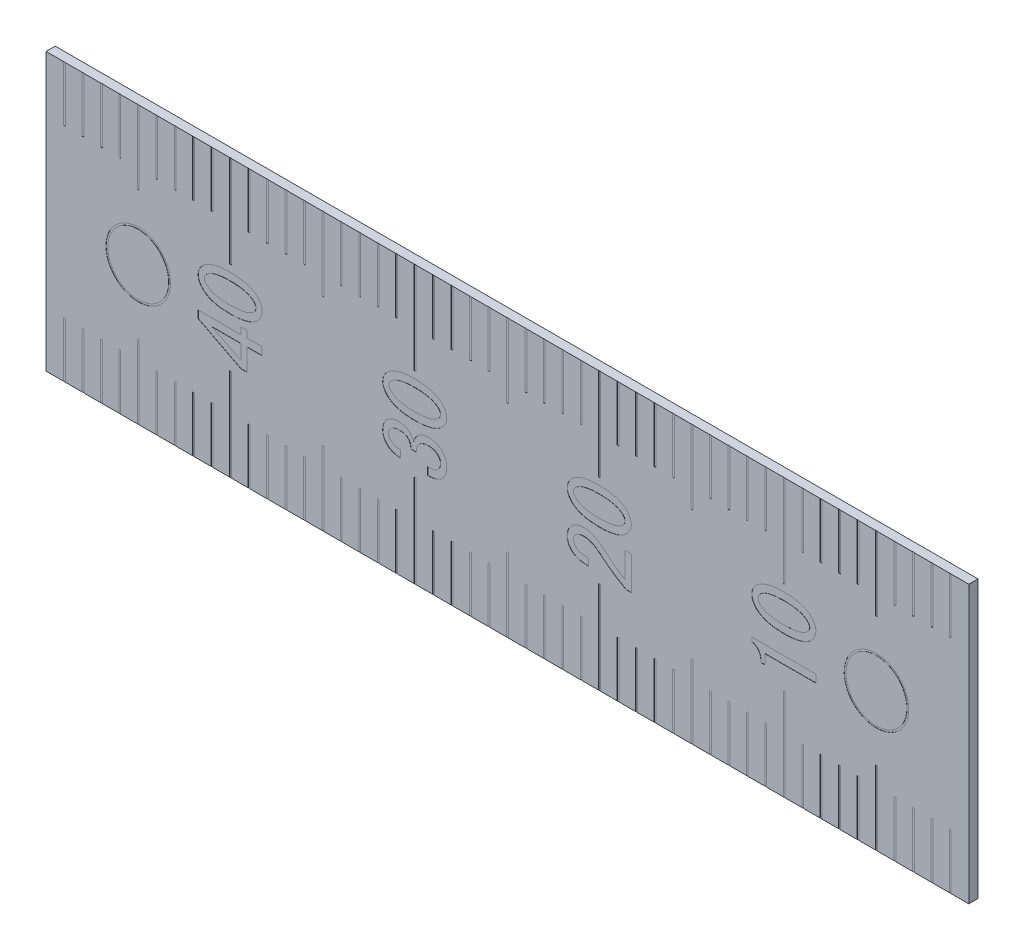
SolidWorks part; units mm, degrees
ref_plane "Front" through (0, 0, 0) normal (0, 0, 1) x (1, 0, 0)
ref_plane "Top" through (0, 0, 0) normal (0, 1, 0) x (1, 0, 0)
ref_plane "Right" through (0, 0, 0) normal (1, 0, 0) x (0, 0, -1)
sketch "Sketch1" plane through (0, 0, 0) normal (0, 0, 1) x (1, 0, 0)
  line L1 (0, 0) -> (0, 50)
  line L2 (0, 0) -> (15, 0)
  line L3 (15, 0) -> (15, 50)
  line L4 (0, 50) -> (15, 50)
  dimension "D1" = 50
  dimension "D2" = 15
extrude "Extrude1" add sketch "Sketch1" along normal blind 0.5
sketch "Sketch2" plane through (0, 0, 0.5) normal (0, 0, 1) x (1, 0, 0)
  line L0 (0, 50) -> (0, 0) construction
  line L1 (0, 0) -> (15, 0) construction
  line L2 (15, 50) -> (0, 50) construction
  circle A0 centre (7.5, 5) radius 1.75
  circle A1 centre (7.5, 45) radius 1.75
  circle A2 centre (7.5, 5) radius 1.65
  circle A3 centre (7.5, 45) radius 1.65
  dimension "D1" = 7.5
  dimension "D2" = 7.5
  dimension "D3" = 5
  dimension "D4" = 5
  dimension "D5" = 3.5
  dimension "D6" = 3.5
  dimension "D7" = 0.1
extrude "Extrude2" cut sketch "Sketch2" against normal blind 0.01
sketch "Sketch3" plane through (0, 0, 0.5) normal (0, 0, 1) x (1, 0, 0)
  line L0 (15, 50) -> (0, 50) construction
  line L1 (5.25, 28.25) -> (9.75, 28.25) construction
  line L2 (5.25, 18.25) -> (9.75, 18.25) construction
  line L3 (5.25, 8.25) -> (9.75, 8.25) construction
  line L5 (0, 50) -> (0, 0) construction
  line L7 (5.25, 38.25) -> (9.75, 38.25) construction
  line L8 (5.25, 38.25) -> (5.25, 41.75) construction
  line L9 (7.5, 0) -> (7.5, 50) construction
  line L10 (0, 0) -> (15, 0) construction
  line L11 (0, 40) -> (15, 40) construction
  line L12 (15, 0) -> (15, 50) construction
  line L13 (5.25, 41.75) -> (9.75, 41.75) construction
  line L14 (9.75, 38.25) -> (9.75, 41.75) construction
  line L15 (5.25, 38.25) -> (9.75, 41.75) construction
  line L16 (5.25, 41.75) -> (9.75, 38.25) construction
  circle A0 centre (7.5, 45) radius 1.75 construction
  text T0 "40" font "ＭＳ ゴシック" height 3.5
  text T1 "30" font "ＭＳ ゴシック" height 3.5
  text T2 "20" font "ＭＳ ゴシック" height 3.5
  text T3 "10" font "ＭＳ ゴシック" height 3.5
  point P7 (7.5, 40)
  dimension "D2" = 7.5
  dimension "D1" = 4
  dimension "D6" = 10
  dimension "D5" = 4.5
  dimension "D7" = 3.5
extrude "Extrude3" cut sketch "Sketch3" against normal blind 0.01
sketch "Sketch4" plane through (0, 0, 0.5) normal (0, 0, 1) x (1, 0, 0)
  line L0 (15, 40.05) -> (10, 40.05)
  line L1 (15, 0) -> (15, 50) construction
  line L2 (10, 40.05) -> (10, 39.95)
  line L3 (10, 39.95) -> (15, 39.95)
  line L4 (15, 39.95) -> (15, 40.05)
  line L5 (15, 50) -> (0, 50) construction
  line L6 (15, 48.05) -> (15, 47.95)
  line L7 (15, 44.95) -> (11, 44.95)
  line L8 (15, 44.95) -> (15, 45.05)
  line L9 (15, 45.05) -> (11, 45.05)
  line L10 (11, 44.95) -> (11, 45.05)
  line L11 (15, 49.05) -> (12, 49.05)
  line L12 (15, 49.05) -> (15, 48.95)
  line L13 (15, 48.95) -> (12, 48.95)
  line L14 (12, 49.05) -> (12, 48.95)
  line L15 (15, 48.05) -> (12, 48.05)
  line L16 (15, 47.95) -> (12, 47.95)
  line L17 (12, 48.05) -> (12, 47.95)
  line L18 (15, 47.05) -> (15, 46.95)
  line L19 (15, 47.05) -> (12, 47.05)
  line L20 (15, 46.95) -> (12, 46.95)
  line L21 (12, 47.05) -> (12, 46.95)
  line L22 (15, 46.05) -> (15, 45.95)
  line L23 (15, 46.05) -> (12, 46.05)
  line L24 (15, 45.95) -> (12, 45.95)
  line L25 (12, 46.05) -> (12, 45.95)
  line L26 (15, 30.05) -> (10, 30.05)
  line L27 (10, 30.05) -> (10, 29.95)
  line L28 (10, 29.95) -> (15, 29.95)
  line L29 (15, 29.95) -> (15, 30.05)
  line L30 (15, 44.05) -> (15, 43.95)
  line L31 (15, 44.05) -> (12, 44.05)
  line L32 (15, 43.95) -> (12, 43.95)
  line L33 (12, 44.05) -> (12, 43.95)
  line L34 (15, 43.05) -> (15, 42.95)
  line L35 (15, 43.05) -> (12, 43.05)
  line L36 (15, 42.95) -> (12, 42.95)
  line L37 (12, 43.05) -> (12, 42.95)
  line L38 (15, 42.05) -> (15, 41.95)
  line L39 (15, 42.05) -> (12, 42.05)
  line L40 (15, 41.95) -> (12, 41.95)
  line L41 (12, 42.05) -> (12, 41.95)
  line L42 (15, 41.05) -> (15, 40.95)
  line L43 (15, 41.05) -> (12, 41.05)
  line L44 (15, 40.95) -> (12, 40.95)
  line L45 (12, 41.05) -> (12, 40.95)
  line L46 (12, 45.05) -> (12, 44.95)
  line L47 (15, 45.05) -> (12, 45.05)
  line L48 (15, 44.95) -> (12, 44.95)
  line L49 (15, 45.05) -> (15, 44.95)
  line L50 (15, 38.05) -> (15, 37.95)
  line L51 (15, 34.95) -> (11, 34.95)
  line L52 (15, 34.95) -> (15, 35.05)
  line L53 (15, 35.05) -> (11, 35.05)
  line L54 (11, 34.95) -> (11, 35.05)
  line L55 (15, 39.05) -> (12, 39.05)
  line L56 (15, 39.05) -> (15, 38.95)
  line L57 (15, 38.95) -> (12, 38.95)
  line L58 (12, 39.05) -> (12, 38.95)
  line L59 (15, 38.05) -> (12, 38.05)
  line L60 (15, 37.95) -> (12, 37.95)
  line L61 (12, 38.05) -> (12, 37.95)
  line L62 (15, 37.05) -> (15, 36.95)
  line L63 (15, 37.05) -> (12, 37.05)
  line L64 (15, 36.95) -> (12, 36.95)
  line L65 (12, 37.05) -> (12, 36.95)
  line L66 (15, 36.05) -> (15, 35.95)
  line L67 (15, 36.05) -> (12, 36.05)
  line L68 (15, 35.95) -> (12, 35.95)
  line L69 (12, 36.05) -> (12, 35.95)
  line L70 (15, 34.05) -> (15, 33.95)
  line L71 (15, 34.05) -> (12, 34.05)
  line L72 (15, 33.95) -> (12, 33.95)
  line L73 (12, 34.05) -> (12, 33.95)
  line L74 (15, 33.05) -> (15, 32.95)
  line L75 (15, 33.05) -> (12, 33.05)
  line L76 (15, 32.95) -> (12, 32.95)
  line L77 (12, 33.05) -> (12, 32.95)
  line L78 (15, 32.05) -> (15, 31.95)
  line L79 (15, 32.05) -> (12, 32.05)
  line L80 (15, 31.95) -> (12, 31.95)
  line L81 (12, 32.05) -> (12, 31.95)
  line L82 (15, 31.05) -> (15, 30.95)
  line L83 (15, 31.05) -> (12, 31.05)
  line L84 (15, 30.95) -> (12, 30.95)
  line L85 (12, 31.05) -> (12, 30.95)
  line L86 (15, 20.05) -> (10, 20.05)
  line L87 (10, 20.05) -> (10, 19.95)
  line L88 (10, 19.95) -> (15, 19.95)
  line L89 (15, 19.95) -> (15, 20.05)
  line L90 (15, 28.05) -> (15, 27.95)
  line L91 (15, 24.95) -> (11, 24.95)
  line L92 (15, 24.95) -> (15, 25.05)
  line L93 (15, 25.05) -> (11, 25.05)
  line L94 (11, 24.95) -> (11, 25.05)
  line L95 (15, 29.05) -> (12, 29.05)
  line L96 (15, 29.05) -> (15, 28.95)
  line L97 (15, 28.95) -> (12, 28.95)
  line L98 (12, 29.05) -> (12, 28.95)
  line L99 (15, 28.05) -> (12, 28.05)
  line L100 (15, 27.95) -> (12, 27.95)
  line L101 (12, 28.05) -> (12, 27.95)
  line L102 (15, 27.05) -> (15, 26.95)
  line L103 (15, 27.05) -> (12, 27.05)
  line L104 (15, 26.95) -> (12, 26.95)
  line L105 (12, 27.05) -> (12, 26.95)
  line L106 (15, 26.05) -> (15, 25.95)
  line L107 (15, 26.05) -> (12, 26.05)
  line L108 (15, 25.95) -> (12, 25.95)
  line L109 (12, 26.05) -> (12, 25.95)
  line L110 (15, 24.05) -> (15, 23.95)
  line L111 (15, 24.05) -> (12, 24.05)
  line L112 (15, 23.95) -> (12, 23.95)
  line L113 (12, 24.05) -> (12, 23.95)
  line L114 (15, 23.05) -> (15, 22.95)
  line L115 (15, 23.05) -> (12, 23.05)
  line L116 (15, 22.95) -> (12, 22.95)
  line L117 (12, 23.05) -> (12, 22.95)
  line L118 (15, 22.05) -> (15, 21.95)
  line L119 (15, 22.05) -> (12, 22.05)
  line L120 (15, 21.95) -> (12, 21.95)
  line L121 (12, 22.05) -> (12, 21.95)
  line L122 (15, 21.05) -> (15, 20.95)
  line L123 (15, 21.05) -> (12, 21.05)
  line L124 (15, 20.95) -> (12, 20.95)
  line L125 (12, 21.05) -> (12, 20.95)
  line L126 (15, 10.05) -> (10, 10.05)
  line L127 (10, 10.05) -> (10, 9.95)
  line L128 (10, 9.95) -> (15, 9.95)
  line L129 (15, 9.95) -> (15, 10.05)
  line L130 (15, 18.05) -> (15, 17.95)
  line L131 (15, 14.95) -> (11, 14.95)
  line L132 (15, 14.95) -> (15, 15.05)
  line L133 (15, 15.05) -> (11, 15.05)
  line L134 (11, 14.95) -> (11, 15.05)
  line L135 (15, 19.05) -> (12, 19.05)
  line L136 (15, 19.05) -> (15, 18.95)
  line L137 (15, 18.95) -> (12, 18.95)
  line L138 (12, 19.05) -> (12, 18.95)
  line L139 (15, 18.05) -> (12, 18.05)
  line L140 (15, 17.95) -> (12, 17.95)
  line L141 (12, 18.05) -> (12, 17.95)
  line L142 (15, 17.05) -> (15, 16.95)
  line L143 (15, 17.05) -> (12, 17.05)
  line L144 (15, 16.95) -> (12, 16.95)
  line L145 (12, 17.05) -> (12, 16.95)
  line L146 (15, 16.05) -> (15, 15.95)
  line L147 (15, 16.05) -> (12, 16.05)
  line L148 (15, 15.95) -> (12, 15.95)
  line L149 (12, 16.05) -> (12, 15.95)
  line L150 (15, 14.05) -> (15, 13.95)
  line L151 (15, 14.05) -> (12, 14.05)
  line L152 (15, 13.95) -> (12, 13.95)
  line L153 (12, 14.05) -> (12, 13.95)
  line L154 (15, 13.05) -> (15, 12.95)
  line L155 (15, 13.05) -> (12, 13.05)
  line L156 (15, 12.95) -> (12, 12.95)
  line L157 (12, 13.05) -> (12, 12.95)
  line L158 (15, 12.05) -> (15, 11.95)
  line L159 (15, 12.05) -> (12, 12.05)
  line L160 (15, 11.95) -> (12, 11.95)
  line L161 (12, 12.05) -> (12, 11.95)
  line L162 (15, 11.05) -> (15, 10.95)
  line L163 (15, 11.05) -> (12, 11.05)
  line L164 (15, 10.95) -> (12, 10.95)
  line L165 (12, 11.05) -> (12, 10.95)
  line L166 (7.5, 50) -> (7.5, 36.693) construction
  line L167 (3, 1.05) -> (3, 0.95)
  line L168 (0, 0.95) -> (3, 0.95)
  line L169 (0, 1.05) -> (3, 1.05)
  line L170 (15, 8.05) -> (15, 7.95)
  line L171 (15, 4.95) -> (11, 4.95)
  line L172 (15, 4.95) -> (15, 5.05)
  line L173 (15, 5.05) -> (11, 5.05)
  line L174 (11, 4.95) -> (11, 5.05)
  line L175 (15, 9.05) -> (12, 9.05)
  line L176 (15, 9.05) -> (15, 8.95)
  line L177 (15, 8.95) -> (12, 8.95)
  line L178 (12, 9.05) -> (12, 8.95)
  line L179 (15, 8.05) -> (12, 8.05)
  line L180 (15, 7.95) -> (12, 7.95)
  line L181 (12, 8.05) -> (12, 7.95)
  line L182 (15, 7.05) -> (15, 6.95)
  line L183 (15, 7.05) -> (12, 7.05)
  line L184 (15, 6.95) -> (12, 6.95)
  line L185 (12, 7.05) -> (12, 6.95)
  line L186 (15, 6.05) -> (15, 5.95)
  line L187 (15, 6.05) -> (12, 6.05)
  line L188 (15, 5.95) -> (12, 5.95)
  line L189 (12, 6.05) -> (12, 5.95)
  line L190 (15, 4.05) -> (15, 3.95)
  line L191 (15, 4.05) -> (12, 4.05)
  line L192 (15, 3.95) -> (12, 3.95)
  line L193 (12, 4.05) -> (12, 3.95)
  line L194 (15, 3.05) -> (15, 2.95)
  line L195 (15, 3.05) -> (12, 3.05)
  line L196 (15, 2.95) -> (12, 2.95)
  line L197 (12, 3.05) -> (12, 2.95)
  line L198 (15, 2.05) -> (15, 1.95)
  line L199 (15, 2.05) -> (12, 2.05)
  line L200 (15, 1.95) -> (12, 1.95)
  line L201 (12, 2.05) -> (12, 1.95)
  line L202 (15, 1.05) -> (15, 0.95)
  line L203 (15, 1.05) -> (12, 1.05)
  line L204 (15, 0.95) -> (12, 0.95)
  line L205 (12, 1.05) -> (12, 0.95)
  line L206 (15, 0.05) -> (10, 0.05)
  line L207 (10, 0.05) -> (10, -0.05)
  line L208 (10, -0.05) -> (15, -0.05)
  line L209 (15, -0.05) -> (15, 0.05)
  line L210 (0, 1.05) -> (0, 0.95)
  line L211 (3, 2.05) -> (3, 1.95)
  line L212 (0, 1.95) -> (3, 1.95)
  line L213 (0, 2.05) -> (3, 2.05)
  line L214 (0, 2.05) -> (0, 1.95)
  line L215 (3, 3.05) -> (3, 2.95)
  line L216 (0, 2.95) -> (3, 2.95)
  line L217 (0, 3.05) -> (3, 3.05)
  line L218 (0, 3.05) -> (0, 2.95)
  line L219 (3, 4.05) -> (3, 3.95)
  line L220 (0, 3.95) -> (3, 3.95)
  line L221 (0, 4.05) -> (3, 4.05)
  line L222 (0, 4.05) -> (0, 3.95)
  line L223 (3, 6.05) -> (3, 5.95)
  line L224 (0, 5.95) -> (3, 5.95)
  line L225 (0, 6.05) -> (3, 6.05)
  line L226 (0, 6.05) -> (0, 5.95)
  line L227 (3, 7.05) -> (3, 6.95)
  line L228 (0, 6.95) -> (3, 6.95)
  line L229 (0, 7.05) -> (3, 7.05)
  line L230 (0, 7.05) -> (0, 6.95)
  line L231 (3, 8.05) -> (3, 7.95)
  line L232 (0, 7.95) -> (3, 7.95)
  line L233 (0, 8.05) -> (3, 8.05)
  line L234 (3, 9.05) -> (3, 8.95)
  line L235 (0, 8.95) -> (3, 8.95)
  line L236 (0, 9.05) -> (0, 8.95)
  line L237 (0, 9.05) -> (3, 9.05)
  line L238 (4, 4.95) -> (4, 5.05)
  line L239 (0, 5.05) -> (4, 5.05)
  line L240 (0, 4.95) -> (0, 5.05)
  line L241 (0, 4.95) -> (4, 4.95)
  line L242 (0, 8.05) -> (0, 7.95)
  line L243 (3, 11.05) -> (3, 10.95)
  line L244 (0, 10.95) -> (3, 10.95)
  line L245 (0, 11.05) -> (3, 11.05)
  line L246 (0, 11.05) -> (0, 10.95)
  line L247 (3, 12.05) -> (3, 11.95)
  line L248 (0, 11.95) -> (3, 11.95)
  line L249 (0, 12.05) -> (3, 12.05)
  line L250 (0, 12.05) -> (0, 11.95)
  line L251 (3, 13.05) -> (3, 12.95)
  line L252 (0, 12.95) -> (3, 12.95)
  line L253 (0, 13.05) -> (3, 13.05)
  line L254 (0, 13.05) -> (0, 12.95)
  line L255 (3, 14.05) -> (3, 13.95)
  line L256 (0, 13.95) -> (3, 13.95)
  line L257 (0, 14.05) -> (3, 14.05)
  line L258 (0, 14.05) -> (0, 13.95)
  line L259 (3, 16.05) -> (3, 15.95)
  line L260 (0, 15.95) -> (3, 15.95)
  line L261 (0, 16.05) -> (3, 16.05)
  line L262 (0, 16.05) -> (0, 15.95)
  line L263 (3, 17.05) -> (3, 16.95)
  line L264 (0, 16.95) -> (3, 16.95)
  line L265 (0, 17.05) -> (3, 17.05)
  line L266 (0, 17.05) -> (0, 16.95)
  line L267 (3, 18.05) -> (3, 17.95)
  line L268 (0, 17.95) -> (3, 17.95)
  line L269 (0, 18.05) -> (3, 18.05)
  line L270 (3, 19.05) -> (3, 18.95)
  line L271 (0, 18.95) -> (3, 18.95)
  line L272 (0, 19.05) -> (0, 18.95)
  line L273 (0, 19.05) -> (3, 19.05)
  line L274 (4, 14.95) -> (4, 15.05)
  line L275 (0, 15.05) -> (4, 15.05)
  line L276 (0, 14.95) -> (0, 15.05)
  line L277 (0, 14.95) -> (4, 14.95)
  line L278 (0, 18.05) -> (0, 17.95)
  line L279 (0, 9.95) -> (0, 10.05)
  line L280 (5, 9.95) -> (0, 9.95)
  line L281 (5, 10.05) -> (5, 9.95)
  line L282 (0, 10.05) -> (5, 10.05)
  line L283 (3, 21.05) -> (3, 20.95)
  line L284 (0, 20.95) -> (3, 20.95)
  line L285 (0, 21.05) -> (3, 21.05)
  line L286 (0, 21.05) -> (0, 20.95)
  line L287 (3, 22.05) -> (3, 21.95)
  line L288 (0, 21.95) -> (3, 21.95)
  line L289 (0, 22.05) -> (3, 22.05)
  line L290 (0, 22.05) -> (0, 21.95)
  line L291 (3, 23.05) -> (3, 22.95)
  line L292 (0, 22.95) -> (3, 22.95)
  line L293 (0, 23.05) -> (3, 23.05)
  line L294 (0, 23.05) -> (0, 22.95)
  line L295 (3, 24.05) -> (3, 23.95)
  line L296 (0, 23.95) -> (3, 23.95)
  line L297 (0, 24.05) -> (3, 24.05)
  line L298 (0, 24.05) -> (0, 23.95)
  line L299 (3, 26.05) -> (3, 25.95)
  line L300 (0, 25.95) -> (3, 25.95)
  line L301 (0, 26.05) -> (3, 26.05)
  line L302 (0, 26.05) -> (0, 25.95)
  line L303 (3, 27.05) -> (3, 26.95)
  line L304 (0, 26.95) -> (3, 26.95)
  line L305 (0, 27.05) -> (3, 27.05)
  line L306 (0, 27.05) -> (0, 26.95)
  line L307 (3, 28.05) -> (3, 27.95)
  line L308 (0, 27.95) -> (3, 27.95)
  line L309 (0, 28.05) -> (3, 28.05)
  line L310 (3, 29.05) -> (3, 28.95)
  line L311 (0, 28.95) -> (3, 28.95)
  line L312 (0, 29.05) -> (0, 28.95)
  line L313 (0, 29.05) -> (3, 29.05)
  line L314 (4, 24.95) -> (4, 25.05)
  line L315 (0, 25.05) -> (4, 25.05)
  line L316 (0, 24.95) -> (0, 25.05)
  line L317 (0, 24.95) -> (4, 24.95)
  line L318 (0, 28.05) -> (0, 27.95)
  line L319 (0, 19.95) -> (0, 20.05)
  line L320 (5, 19.95) -> (0, 19.95)
  line L321 (5, 20.05) -> (5, 19.95)
  line L322 (0, 20.05) -> (5, 20.05)
  line L323 (3, 31.05) -> (3, 30.95)
  line L324 (0, 30.95) -> (3, 30.95)
  line L325 (0, 31.05) -> (3, 31.05)
  line L326 (0, 31.05) -> (0, 30.95)
  line L327 (3, 32.05) -> (3, 31.95)
  line L328 (0, 31.95) -> (3, 31.95)
  line L329 (0, 32.05) -> (3, 32.05)
  line L330 (0, 32.05) -> (0, 31.95)
  line L331 (3, 33.05) -> (3, 32.95)
  line L332 (0, 32.95) -> (3, 32.95)
  line L333 (0, 33.05) -> (3, 33.05)
  line L334 (0, 33.05) -> (0, 32.95)
  line L335 (3, 34.05) -> (3, 33.95)
  line L336 (0, 33.95) -> (3, 33.95)
  line L337 (0, 34.05) -> (3, 34.05)
  line L338 (0, 34.05) -> (0, 33.95)
  line L339 (3, 36.05) -> (3, 35.95)
  line L340 (0, 35.95) -> (3, 35.95)
  line L341 (0, 36.05) -> (3, 36.05)
  line L342 (0, 36.05) -> (0, 35.95)
  line L343 (3, 37.05) -> (3, 36.95)
  line L344 (0, 36.95) -> (3, 36.95)
  line L345 (0, 37.05) -> (3, 37.05)
  line L346 (0, 37.05) -> (0, 36.95)
  line L347 (3, 38.05) -> (3, 37.95)
  line L348 (0, 37.95) -> (3, 37.95)
  line L349 (0, 38.05) -> (3, 38.05)
  line L350 (3, 39.05) -> (3, 38.95)
  line L351 (0, 38.95) -> (3, 38.95)
  line L352 (0, 39.05) -> (0, 38.95)
  line L353 (0, 39.05) -> (3, 39.05)
  line L354 (4, 34.95) -> (4, 35.05)
  line L355 (0, 35.05) -> (4, 35.05)
  line L356 (0, 34.95) -> (0, 35.05)
  line L357 (0, 34.95) -> (4, 34.95)
  line L358 (0, 38.05) -> (0, 37.95)
  line L359 (3, 41.05) -> (3, 40.95)
  line L360 (0, 40.95) -> (3, 40.95)
  line L361 (0, 41.05) -> (3, 41.05)
  line L362 (0, 41.05) -> (0, 40.95)
  line L363 (3, 42.05) -> (3, 41.95)
  line L364 (0, 41.95) -> (3, 41.95)
  line L365 (0, 42.05) -> (3, 42.05)
  line L366 (0, 42.05) -> (0, 41.95)
  line L367 (3, 43.05) -> (3, 42.95)
  line L368 (0, 42.95) -> (3, 42.95)
  line L369 (0, 43.05) -> (3, 43.05)
  line L370 (0, 43.05) -> (0, 42.95)
  line L371 (3, 44.05) -> (3, 43.95)
  line L372 (0, 43.95) -> (3, 43.95)
  line L373 (0, 44.05) -> (3, 44.05)
  line L374 (0, 44.05) -> (0, 43.95)
  line L375 (0, 29.95) -> (0, 30.05)
  line L376 (5, 29.95) -> (0, 29.95)
  line L377 (5, 30.05) -> (5, 29.95)
  line L378 (0, 30.05) -> (5, 30.05)
  line L379 (3, 46.05) -> (3, 45.95)
  line L380 (0, 45.95) -> (3, 45.95)
  line L381 (0, 46.05) -> (3, 46.05)
  line L382 (0, 46.05) -> (0, 45.95)
  line L383 (3, 47.05) -> (3, 46.95)
  line L384 (0, 46.95) -> (3, 46.95)
  line L385 (0, 47.05) -> (3, 47.05)
  line L386 (0, 47.05) -> (0, 46.95)
  line L387 (3, 48.05) -> (3, 47.95)
  line L388 (0, 47.95) -> (3, 47.95)
  line L389 (0, 48.05) -> (3, 48.05)
  line L390 (3, 49.05) -> (3, 48.95)
  line L391 (0, 48.95) -> (3, 48.95)
  line L392 (0, 49.05) -> (0, 48.95)
  line L393 (0, 49.05) -> (3, 49.05)
  line L394 (4, 44.95) -> (4, 45.05)
  line L395 (0, 45.05) -> (4, 45.05)
  line L396 (0, 44.95) -> (0, 45.05)
  line L397 (0, 44.95) -> (4, 44.95)
  line L398 (0, 48.05) -> (0, 47.95)
  line L399 (0, 39.95) -> (0, 40.05)
  line L400 (5, 39.95) -> (0, 39.95)
  line L401 (5, 40.05) -> (5, 39.95)
  line L402 (0, 40.05) -> (5, 40.05)
  point P4 (15, 40)
  point P13 (15, 45)
  point P18 (15, 49)
  dimension "D1" = 10
  dimension "D2" = 0.1
  dimension "D3" = 5
  dimension "D4" = 5
  dimension "D5" = 0.1
  dimension "D6" = 1
  dimension "D7" = 0.1
  dimension "D8" = 3
  dimension "D9" = 4
  dimension "D10" = 9
  dimension "D11" = 5
extrude "Extrude4" cut sketch "Sketch4" against normal blind 0.01
move or copy body "Body-Move/Copy2" bodies to move or copy 105 copy no rotation origin (0, 0, 0) rotation axis (0, 0, 1) rotation angle 90
move or copy body "Body-Move/Copy3" bodies to move or copy 107 copy no translate (0, -7.5, 0)
